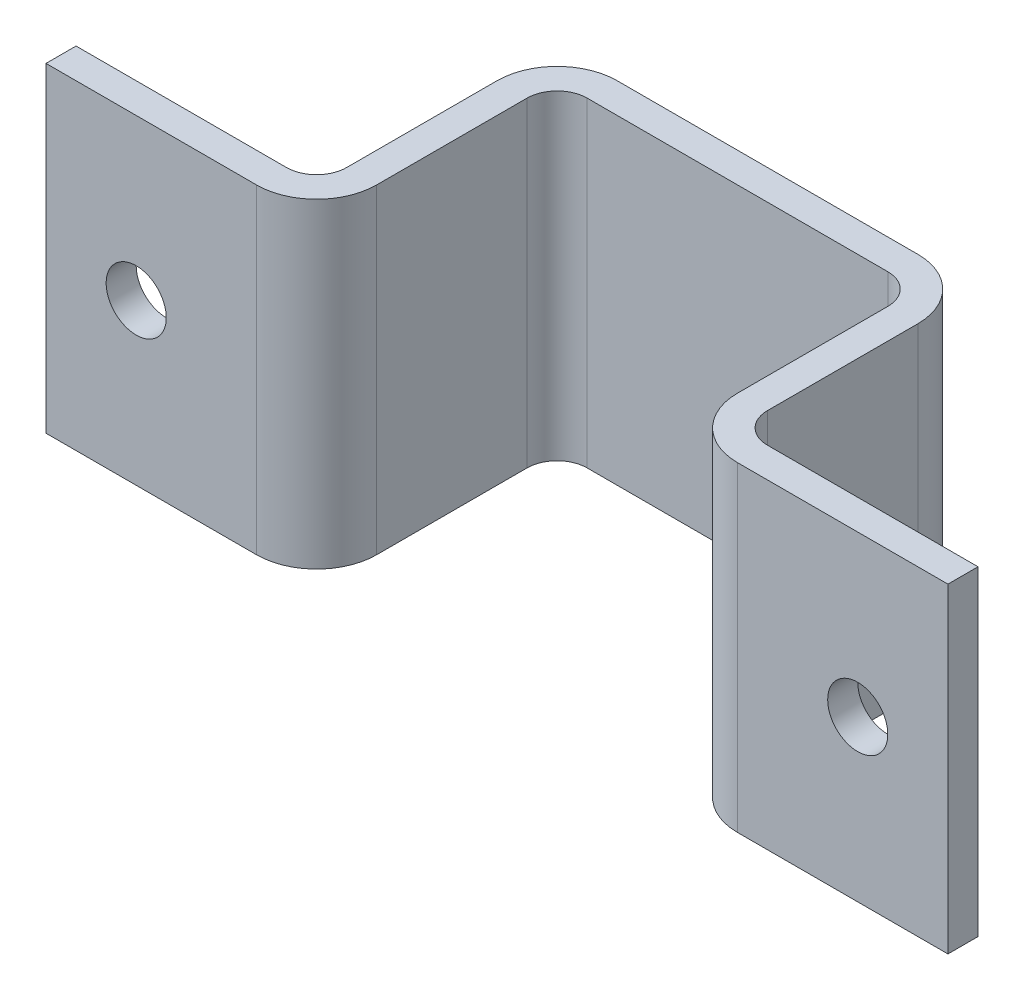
SolidWorks part; units mm, degrees
ref_plane "Front" through (0, 0, 0) normal (0, 0, 1) x (1, 0, 0)
ref_plane "Top" through (0, 0, 0) normal (0, 1, 0) x (1, 0, 0)
ref_plane "Right" through (0, 0, 0) normal (1, 0, 0) x (0, 0, -1)
sketch "Sketch2" plane through (0, 0, 0) normal (0, 1, 0) x (1, 0, 0)
  line L0 (-75, 0) -> (-30, 0)
  line L2 (-30, 0) -> (-30, 40)
  line L3 (-30, 40) -> (30, 40)
  line L4 (0, 47.3204) -> (0, -33.4471) construction
  line L5 (30, 0) -> (30, 40)
  line L6 (75, 0) -> (30, 0)
  point P10 (0, 40)
  dimension "D1" = 30
  dimension "D2" = 40
  dimension "D3" = 45
extrude "Extrude-Thin1" add sketch "Sketch2" along normal mid plane 53.2697 thin
sketch "Sketch3" plane through (0, 0, -5) normal (0, 0, -1) x (-1, 0, 0)
  line L0 (75, 26.6348) -> (75, -26.6348) construction
  circle A0 centre (60, 0) radius 5
  dimension "D2" = 10
  dimension "D1" = 15
extrude "Cut-Extrude1" cut sketch "Sketch3" against normal through all
pattern_linear "LPattern1" count 2 spacing 120 along (1, 0, 0) of "Cut-Extrude1"
